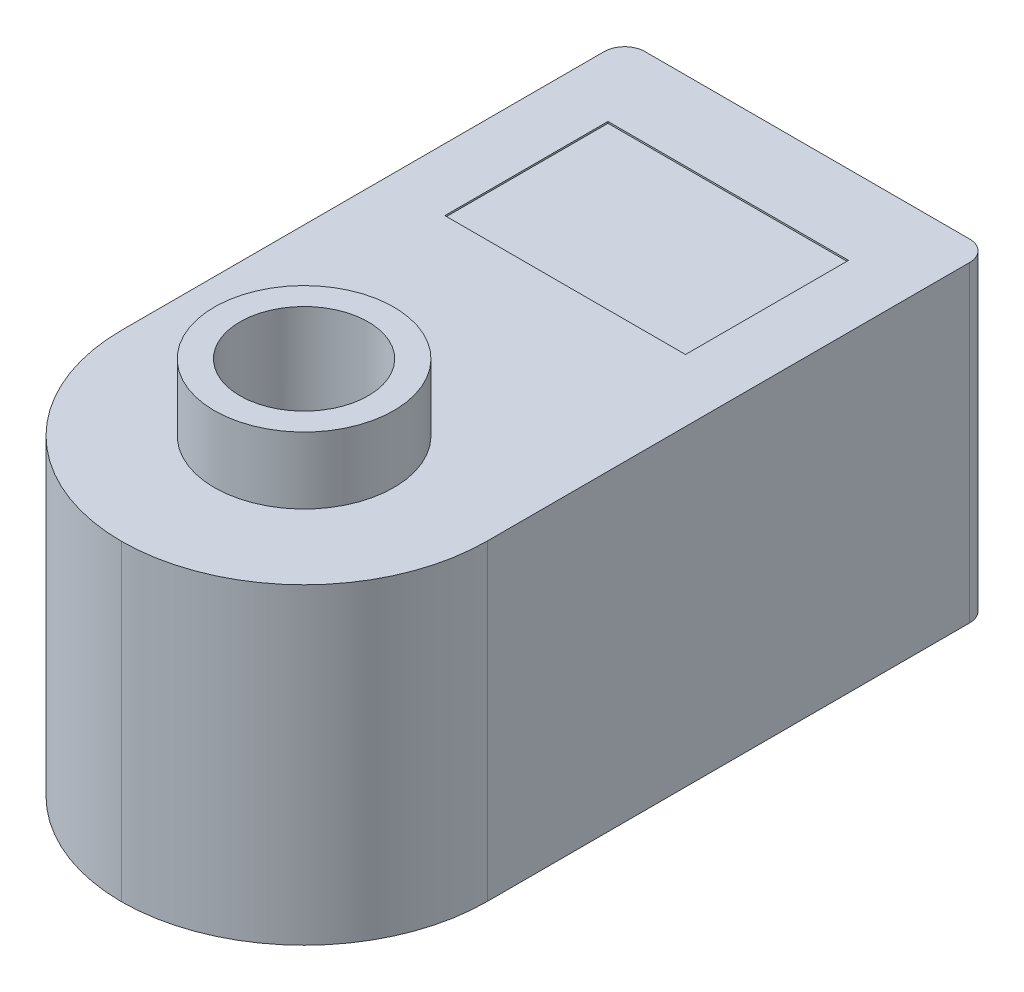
SolidWorks part; units mm, degrees
ref_plane "Front Plane" through (0, 0, 0) normal (0, 0, 1) x (1, 0, 0)
ref_plane "Top Plane" through (0, 0, 0) normal (0, 1, 0) x (1, 0, 0)
ref_plane "Right Plane" through (0, 0, 0) normal (1, 0, 0) x (0, 0, -1)
sketch "Sketch1" plane through (0, 0, 0) normal (0, 1, 0) x (1, 0, 0)
  line L0 (0, -28.5) -> (0, 0) construction
  line L1 (-28.5, 78.5) -> (28.5, 78.5)
  line L2 (-28.5, 78.5) -> (-28.5, -28.5)
  line L3 (-28.5, -28.5) -> (28.5, -28.5)
  line L4 (28.5, 78.5) -> (28.5, -28.5)
  point P7 (0, 68)
  dimension "D1" = 57
  dimension "D2" = 107
  dimension "D3" = 28.5
  dimension "D4" = 68
extrude "Boss-Extrude1" add sketch "Sketch1" along normal mid plane 48.7
sketch "Sketch2" plane through (0, 24.35, 0) normal (0, 1, 0) x (1, 0, 0)
  circle A0 centre (0, 0) radius 14
  dimension "D1" = 28
extrude "Boss-Extrude2" add sketch "Sketch2" along normal blind 10.4
sketch "Sketch3" plane through (0, 34.75, 0) normal (0, 1, 0) x (1, 0, 0)
  circle A0 centre (0, 0) radius 10
  dimension "D1" = 20
extrude "Cut-Extrude1" cut sketch "Sketch3" against normal through all
fillet "Fillet1" radius 28.575 2 edges at (28.5, 0, 28.5) (-28.5, 0, 28.5)
sketch "Sketch4" plane through (0, -24.35, 0) normal (0, -1, 0) x (1, 0, 0)
  circle A0 centre (0, -68) radius 3
  dimension "D1" = 6
extrude "Boss-Extrude3" add sketch "Sketch4" along normal blind 6.5
fillet "Fillet2" radius 3.175 2 edges at (-28.5, 0, -78.5) (28.5, 0, -78.5)
sketch "Sketch5" plane through (0, 24.35, 0) normal (0, 1, 0) x (1, 0, 0)
  line L0 (0, 0) -> (0, 40.7339) construction
  line L1 (-18.7676, 66.1729) -> (18.7676, 66.1729)
  line L2 (-18.7676, 66.1729) -> (-18.7676, 40.7339)
  line L3 (-18.7676, 40.7339) -> (18.7676, 40.7339)
  line L4 (18.7676, 66.1729) -> (18.7676, 40.7339)
extrude "Cut-Extrude2" cut sketch "Sketch5" against normal blind 0.254
sketch "Sketch6" plane through (0, -24.35, 0) normal (0, -1, 0) x (1, 0, 0)
  circle A0 centre (0, 0) radius 18.5
  dimension "D1" = 37
extrude "Cut-Extrude3" cut sketch "Sketch6" against normal blind 20
